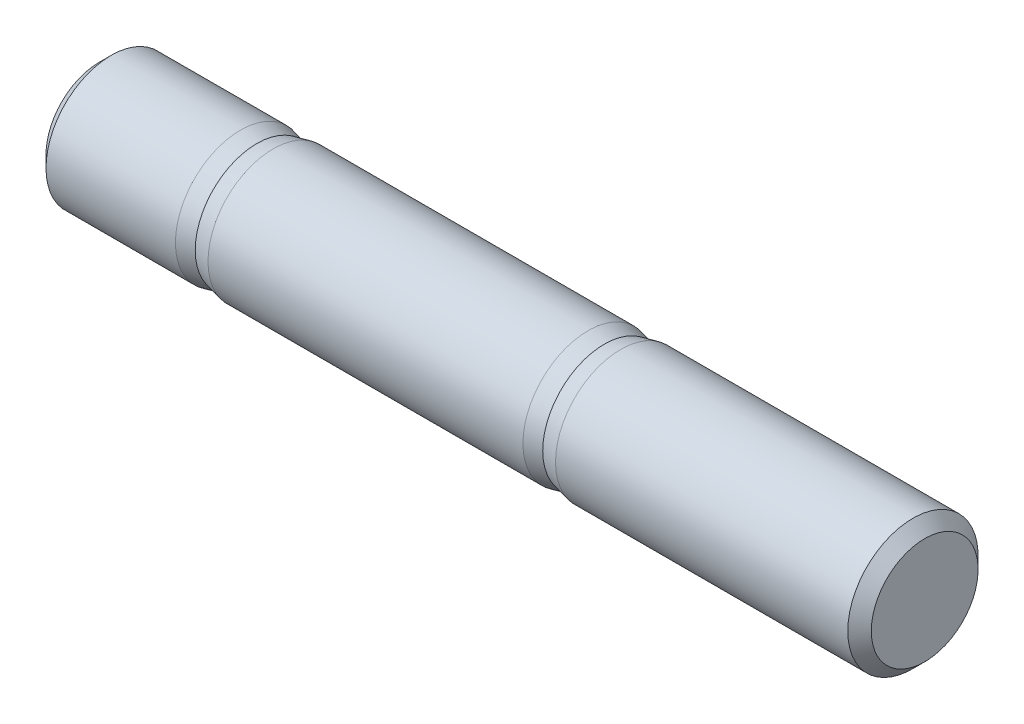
SolidWorks part; units mm, degrees
ref_plane "Front" through (0, 0, 0) normal (0, 0, 1) x (1, 0, 0)
ref_plane "Top" through (0, 0, 0) normal (0, 1, 0) x (1, 0, 0)
ref_plane "Right" through (0, 0, 0) normal (1, 0, 0) x (0, 0, -1)
sketch "Sketch1" plane through (0, 0, 0) normal (0, 0, 1) x (1, 0, 0)
  line L0 (-1.3108, 0) -> (30.3862, 0) construction
  line L1 (0, 0) -> (0, 3)
  line L2 (0, 3) -> (6.5, 3)
  line L3 (6.5, 3) -> (8, 2.675)
  line L4 (8, 2.675) -> (22.5, 2.675)
  line L5 (22.5, 2.675) -> (24, 3)
  line L6 (24, 3) -> (38, 3)
  line L7 (38, 3) -> (38, 0)
  line L8 (38, 0) -> (0, 0)
  dimension "X" = 1.5
  dimension "D2" = 1.5
  dimension "bm" = 8
  dimension "b" = 14
  dimension "l" = 30
  dimension "d" = 6
  dimension "ds" = 5.35
revolve "BaseHead" add sketch "Sketch1" angle 360 about L0
chamfer "HeadChamfer" distance 0.5415 angle 45 2 edges at (0, 0, 3) (38, 0, 3)
sketch "Sketch2" plane through (0, 0, 0) normal (0, 0, 1) x (1, 0, 0)
  line L0 (-1.3108, 0) -> (31.2107, 0) construction
  line L1 (24, 3) -> (24, -3) construction
  line L2 (6.5, 2.675) -> (8, 3)
  line L3 (8, 3) -> (22.5, 3)
  line L4 (22.5, 3) -> (24, 2.675)
  line L5 (6.5, 3) -> (6.5, -3) construction
  line L9 (6.5, 2.675) -> (24, 2.675)
  dimension "D1" = 1.5
  dimension "D2" = 6
revolve "BaseBody" add sketch "Sketch2" angle 360 about L0
sketch "Sketch3" plane through (0, 0, 0) normal (0, 0, 1) x (1, 0, 0)
  line L0 (37.4585, 2.531) -> (37.7292, 3)
  line L1 (37.7292, 3) -> (37.7292, 3.5)
  line L2 (37.7292, 3.5) -> (37.1877, 3.5)
  line L3 (37.1877, 3.5) -> (37.1877, 3)
  line L4 (37.1877, 3) -> (37.4585, 2.531)
  line L5 (0, 0) -> (46.2373, 0) construction
  line L6 (37.4585, 3) -> (37.4585, -3) construction
  dimension "D1" = 60
  dimension "D2" = 60
  dimension "D3" = 0.5
  dimension "D4" = 0.5415
  dimension "D5" = 6
revolve "Cut-Revolve10" [suppressed] cut sketch "Sketch3" angle 360 about L5
pattern_linear "LPattern10" [suppressed] count 22 spacing 0.6498 along (1, 0, 0)
sketch "Sketch4" plane through (0, 0, 0) normal (0, 0, 1) x (1, 0, 0)
  line L0 (0.5415, 2.531) -> (0.8123, 3)
  line L1 (0.8123, 3) -> (0.8123, 3.5)
  line L2 (0.8123, 3.5) -> (0.2708, 3.5)
  line L3 (0.2708, 3.5) -> (0.2708, 3)
  line L4 (0.2708, 3) -> (0.5415, 2.531)
  line L5 (0, 0) -> (8.4336, 0) construction
  line L6 (0, 2.4585) -> (0, -2.4585) construction
  line L7 (0.5415, 3) -> (0.5415, -3) construction
  dimension "D1" = 60
  dimension "D2" = 60
  dimension "D3" = 0.5
  dimension "D4" = 0.5415
  dimension "D5" = 6
revolve "Cut-Revolve11" [suppressed] cut sketch "Sketch4" angle 360 about L5
pattern_linear "LPattern11" [suppressed] count 10 spacing 0.6498 along (1, 0, 0)
equation "\"D2@Sketch1\" = \"X@Sketch1\""
equation "\"D2@ThreadCosmetic2\" = \"D2@ThreadCosmetic1\""
equation "\"D1@ThreadCosmetic1\" = \"bm@Sketch1\"-\"X@Sketch1\""
equation "\"b@ThreadCosmetic2\" = \"b@Sketch1\""
equation "\"D1@Sketch2\" = \"X@Sketch1\""
equation "\"D2@Sketch2\" = \"d@Sketch1\""
equation "\"D1@HeadChamfer\" =  ( \"d@Sketch1\" - \"D2@ThreadCosmetic1\" )  / 2"
equation "\"D5@Sketch3\" = \"d@Sketch1\""
equation "\"D4@Sketch3\" =  ( \"d@Sketch1\" - \"D2@ThreadCosmetic2\" )  / 2"
equation "\"D3@LPattern10\" = \"D4@Sketch3\" * 1.2"
equation "\"D1@LPattern10\" = \"b@ThreadCosmetic2\" / \"D3@LPattern10\""
equation "\"D5@Sketch4\" = \"d@Sketch1\""
equation "\"D4@Sketch4\" =  ( \"d@Sketch1\" - \"D2@ThreadCosmetic1\" )  / 2"
equation "\"D3@LPattern11\" = \"D4@Sketch4\" * 1.2"
equation "\"D1@LPattern11\" = \"D1@ThreadCosmetic1\" / \"D3@LPattern11\""
